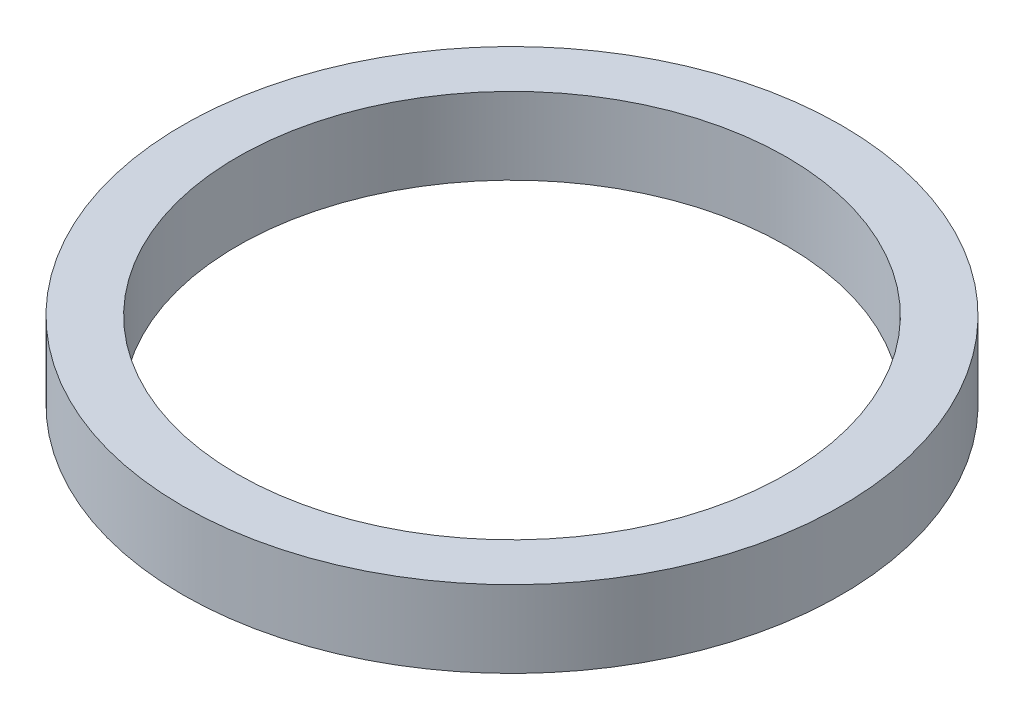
SolidWorks part; units mm, degrees
ref_plane "Front Plane" through (0, 0, 0) normal (0, 0, 1) x (1, 0, 0)
ref_plane "Top Plane" through (0, 0, 0) normal (0, 1, 0) x (1, 0, 0)
ref_plane "Right Plane" through (0, 0, 0) normal (1, 0, 0) x (0, 0, -1)
sketch "Sketch1" plane through (0, 0, 0) normal (0, 1, 0) x (1, 0, 0)
  circle A0 centre (0, 0) radius 15
  dimension "D1" = 30
extrude "Boss-Extrude1" add sketch "Sketch1" along normal blind 3.5 contours A0
sketch "Sketch2" plane through (0, 3.5, 0) normal (0, 1, 0) x (1, 0, 0)
  circle A0 centre (0, 0) radius 12.5
  dimension "D1" = 25
extrude "Cut-Extrude1" cut sketch "Sketch2" against normal blind 3.5
